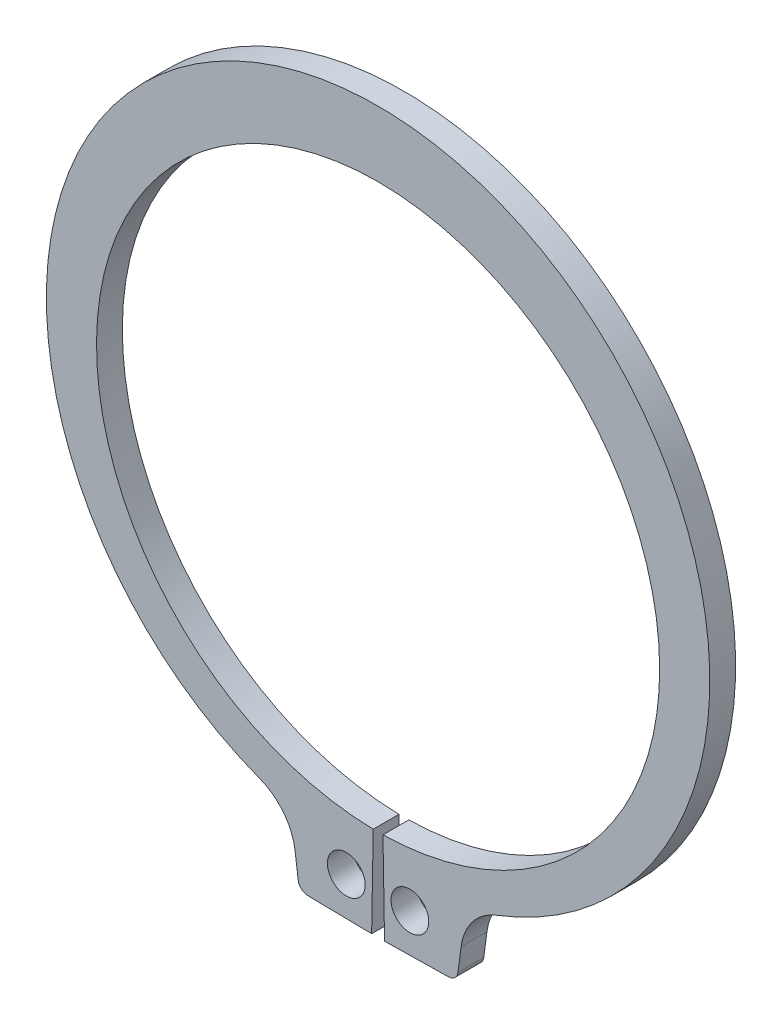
SolidWorks part; units mm, degrees
ref_plane "Plane1" through (0, 0, 0) normal (0, 0, 1) x (1, 0, 0)
ref_plane "Plane2" through (0, 0, 0) normal (0, 1, 0) x (1, 0, 0)
ref_plane "Plane3" through (0, 0, 0) normal (1, 0, 0) x (0, 0, -1)
extrude "Body" add sketch "BodySke" against normal blind 1.3
sketch "BodySke" plane through (0, 0, 0) normal (0, 0, 1) x (1, 0, 0)
  line L0 (-1.5431, 0) -> (1.5431, 0) construction
  line L1 (0, 0) -> (0, 17.475) construction
  line L2 (0.2454, -14.1729) -> (0.325, -18.7722)
  line L3 (-0.2454, -14.1729) -> (-0.325, -18.7722)
  line L4 (0, 0) -> (6.9561, -17.4388) construction
  line L5 (0, 0) -> (-6.9561, -17.4388) construction
  line L6 (0.325, -18.7722) -> (3.5343, -18.7166)
  line L7 (4.1805, -17.0734) -> (4.0213, -18.282)
  line L8 (-4.1805, -17.0734) -> (-4.0213, -18.282)
  line L9 (-0.325, -18.7722) -> (-3.5343, -18.7166)
  circle A0 centre (0, 0) radius 14.175 construction
  arc A1 (0.2454, -14.1729) -> (-0.2454, -14.1729) centre (0, 0) ccw
  arc A2 (5.9187, -14.8381) -> (-5.9187, -14.8381) centre (0, 0.7764) ccw construction
  arc A3 (0.325, -18.7722) -> (4.7016, -18.1768) centre (0, 0) ccw construction
  arc A4 (5.9574, -14.8234) -> (4.1805, -17.0734) centre (6.9561, -17.4388) ccw
  arc A5 (-4.1805, -17.0734) -> (-5.9574, -14.8234) centre (-6.9561, -17.4388) ccw
  arc A6 (-4.7016, -18.1768) -> (-0.325, -18.7722) centre (0, 0) ccw construction
  arc A7 (5.9574, -14.8234) -> (-5.9574, -14.8234) centre (0, 0.7764) ccw
  arc A8 (-4.2774, -16.3368) -> (4.2774, -16.3368) centre (0, 0) ccw construction
  circle A9 centre (1.6, -16.8115) radius 0.95
  circle A10 centre (-1.6, -16.8115) radius 0.95
  arc A11 (4.0213, -18.282) -> (3.5343, -18.7166) centre (3.5256, -18.2167) cw
  arc A12 (-4.0213, -18.282) -> (-3.5343, -18.7166) centre (-3.5256, -18.2167) ccw
  point P28 (4.0136, -18.341)
  point P31 (-4.0136, -18.341)
  dimension "GrooveDia" = 28.35
  dimension "D3" = 0.5
  dimension "LugRad" = 18.775
  dimension "HoleOffsetRad" = 16.8875
  dimension "HoleDia" = 1.9
  dimension "D2" = 15
  dimension "LargeRad" = 17.475
  dimension "SmallRad" = 15.975
  dimension "Gap" = 0.65
  dimension "SmallAngle" = 43.493
  dimension "HoleSpacing" = 3.2
sketch "Clipboard" plane through (0, 0, 0) normal (0, 0, 1) x (1, 0, 0)
  line L0 (0, 0) -> (3.3, 0)
  line L1 (0, 0) -> (0, 1.8)
  line L2 (0, 0) -> (0, -4.6)
  circle A0 centre (0, 0) radius 0.95
  circle A1 centre (0, 0) radius 15
  dimension "HoleDia" = 1.9
  dimension "ShaftDia" = 30
  dimension "LargeSection" = 3.3
  dimension "SmallSection" = 1.8
  dimension "LugSection" = 4.6
sketch "NotSke" plane through (0, 0, 0) normal (0, 0, 1) x (1, 0, 0)
  line L0 (1.6, -15.8615) -> (1.6, -17.7615)
  line L1 (1.6, -17.7615) -> (-1.6, -17.7615)
  line L2 (-1.6, -17.7615) -> (-1.6, -15.8615)
  line L3 (-1.6, -15.8615) -> (1.6, -15.8615)
  circle A0 centre (1.6, -16.8115) radius 0.95 construction
  circle A1 centre (-1.6, -16.8115) radius 0.95 construction
extrude "Notch" [suppressed] cut sketch "NotSke" against normal through all
equation "' \"ShaftDia@Clipboard\" = 4"
equation "' \"Thickness@Body\" = 0.25"
equation "' \"GrooveDia@BodySke\" = 3.8"
equation "' \"LugSection@Clipboard\" = 1.35"
equation "' \"LargeSection@Clipboard\" = 0.65"
equation "' \"SmallSection@Clipboard\" = 0.4"
equation "' \"HoleDia@Clipboard\" = 0.6"
equation "' \"ShaftDia@Clipboard\" = 15"
equation "' \"Thickness@Body\" = 0.9"
equation "' \"GrooveDia@BodySke\" = 14.15"
equation "' \"LugSection@Clipboard\" = 2.8"
equation "' \"LargeSection@Clipboard\" = 1.8"
equation "' \"SmallSection@Clipboard\" = 1.05"
equation "' \"HoleDia@Clipboard\" = 1.2"
equation "\"Gap@BodySke\" =  \"Thickness@Body\" / 2"
equation "\"LargeRad@BodySke\" =  \"GrooveDia@BodySke\" / 2 +  \"LargeSection@Clipboard\""
equation "\"SmallRad@BodySke\" =  \"GrooveDia@BodySke\" / 2 +  \"SmallSection@Clipboard\""
equation "\"LugRad@BodySke\" = \"GrooveDia@BodySke\" / 2 + \"LugSection@Clipboard\""
equation "\"HoleOffsetRad@BodySke\" = (  \"ShaftDia@Clipboard\" / 2 + \"LugRad@BodySke\" ) / 2"
equation "\"HoleSpacing@BodySke\" = \"Gap@BodySke\"  * 2 +  \"HoleDia@Clipboard\""
equation "\"HoleDia@BodySke\" =  \"HoleDia@Clipboard\""
equation "\"SmallAngle@BodySke\" = atn(\"HoleSpacing@BodySke\" / 2 / sqr(\"HoleOffsetRad@BodySke\"  * \"HoleOffsetRad@BodySke\" - (\"HoleSpacing@BodySke\" / 2) * (\"HoleSpacing@BodySke\" / 2) ))  * 8 * ( 180 / 3.141593)"
